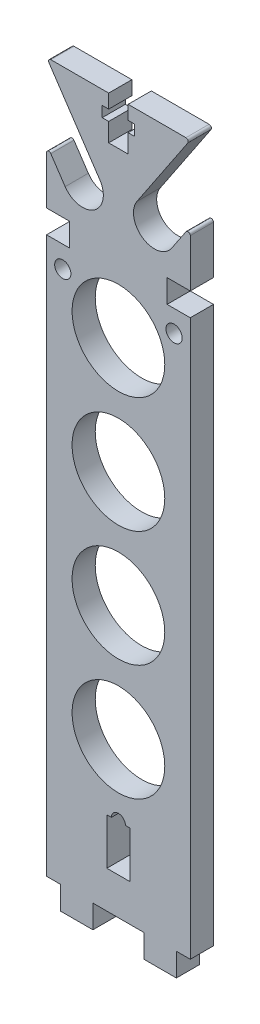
SolidWorks part; units mm, degrees
ref_plane "Plan de face" through (0, 0, 0) normal (0, 0, 1) x (1, 0, 0)
ref_plane "Plan de dessus" through (0, 0, 0) normal (0, 1, 0) x (1, 0, 0)
ref_plane "Plan de droite" through (0, 0, 0) normal (1, 0, 0) x (0, 0, -1)
sketch "Esquisse1" plane through (0, 0, 0) normal (0, 0, 1) x (1, 0, 0)
  line L0 (-15.5, 0) -> (-12.5, 0)
  line L1 (-12.5, 0) -> (-12.5, -5)
  line L2 (-12.5, -5) -> (-5.5, -5)
  line L3 (-5.5, -5) -> (-5.5, 0)
  line L4 (-5.5, 0) -> (5.5, 0)
  line L5 (5.5, 0) -> (5.5, -5)
  line L6 (5.5, -5) -> (12.5, -5)
  line L7 (12.5, -5) -> (12.5, 0)
  line L8 (12.5, 0) -> (15.5, 0)
  line L9 (15.5, 0) -> (15.5, 170)
  line L10 (15.5, 170) -> (-15.5, 170)
  line L11 (-15.5, 170) -> (-15.5, 0)
  dimension "D1" = 7
  dimension "D2" = 7
  dimension "D3" = 3
  dimension "D4" = 3
  dimension "D5" = 170
  dimension "D6" = 11
  dimension "D7" = 15.5
  dimension "D8" = 5
  dimension "D9" = 5
extrude "Boss.-Extru.1" add sketch "Esquisse1" along normal blind 5
sketch "Esquisse6" plane through (0, 0, 0) normal (0, 0, -1) x (-1, 0, 0)
  line L0 (1.5094, 18) -> (2.5, 18)
  line L1 (-2.5, 18) -> (-1.5094, 18)
  line L2 (-2.5, 18) -> (-2.5, 8)
  line L3 (-2.5, 8) -> (2.5, 8)
  line L4 (2.5, 18) -> (2.5, 8)
  arc A1 (1.5094, 18) -> (-1.5094, 18) centre (0, 18) ccw
  point P4 (0, 8)
  dimension "D1" = 10
  dimension "D2" = 5
  dimension "D3" = 0
  dimension "D4" = 8
extrude "Enlèv. mat.-Extru.5" cut sketch "Esquisse6" against normal blind 10
sketch "Esquisse7" plane through (0, 0, 0) normal (0, 0, -1) x (-1, 0, 0)
  line L0 (-4.0103, 135.8329) -> (-15.5, 153)
  line L1 (-15.5, 0) -> (-15.5, 170) construction
  line L3 (-11.4897, 130.8271) -> (-15.5, 136.819)
  line L4 (-15.5, 153) -> (-15.5, 136.819)
  arc A1 (-11.4897, 130.8271) -> (-4.0103, 135.8329) centre (-7.75, 133.33) ccw
  dimension "D1" = 9
  dimension "D2" = 7.75
  dimension "D3" = 133.33
  dimension "D4" = 17
extrude "Enlèv. mat.-Extru.6" cut sketch "Esquisse7" against normal blind 10
mirror "Symétrie1" about plane through (0, 0, 0) normal (1, 0, 0) of "Enlèv. mat.-Extru.6"
sketch "Esquisse9" plane through (0, 0, 0) normal (0, 0, -1) x (-1, 0, 0)
  line L6 (-15.5, 170) -> (15.5, 170)
  line L7 (-15.5, 170) -> (-15.5, 153)
  line L8 (-15.5, 153) -> (15.5, 153)
  line L9 (15.5, 170) -> (15.5, 153)
  dimension "D1" = 17
  dimension "D2" = 31
extrude "Enlèv. mat.-Extru.7" cut sketch "Esquisse9" against normal blind 10
sketch "Esquisse10" plane through (0, 0, 0) normal (0, 0, -1) x (-1, 0, 0)
  circle A0 centre (0, 108.33) radius 10
  arc A1 (4.0103, 135.8329) -> (11.4897, 130.8271) centre (7.75, 133.33) ccw construction
  circle A2 centre (0, 83.33) radius 10
  circle A3 centre (0, 58.33) radius 10
  circle A4 centre (0, 33.33) radius 10
  dimension "D1" = 20
  dimension "D2" = 25
  dimension "D3" = 20
  dimension "D5" = 20
  dimension "D7" = 20
  dimension "D4" = 25
  dimension "D6" = 25
  dimension "D8" = 25
extrude "Enlèv. mat.-Extru.8" cut sketch "Esquisse10" against normal blind 10
fillet "Congé2" radius 0.5 2 edges at (15.5, 153, 2.5) (-15.5, 153, 2.5)
fillet "Congé3" radius 0.5 2 edges at (-15.5, 136.819, 2.5) (15.5, 136.819, 2.5)
sketch "Esquisse11" plane through (0, 0, 0) normal (0, 0, -1) x (-1, 0, 0)
  line L0 (-15.5, 0) -> (-15.5, 135.173) construction
  line L1 (-15.5, 124.83) -> (-10.5, 124.83)
  line L2 (-15.5, 124.83) -> (-15.5, 119.83)
  line L3 (-15.5, 119.83) -> (-10.5, 119.83)
  line L4 (-10.5, 124.83) -> (-10.5, 119.83)
  arc A0 (-11.4897, 130.8271) -> (-4.0103, 135.8329) centre (-7.75, 133.33) ccw construction
  dimension "D3" = 8.5
  dimension "D1" = 5
  dimension "D2" = 5
extrude "Enlèv. mat.-Extru.9" cut sketch "Esquisse11" against normal blind 30
mirror "Symétrie2" about plane through (0, 0, 0) normal (1, 0, 0) of "Enlèv. mat.-Extru.9"
sketch "Esquisse12" plane through (0, 0, 5) normal (0, 0, 1) x (1, 0, 0)
  line L0 (-14.5637, 153) -> (14.5637, 153) construction
  line L1 (-3.5, 150) -> (-2.1, 150)
  line L2 (-3.5, 150) -> (-3.5, 147.7)
  line L3 (-3.5, 147.7) -> (-2.1, 147.7)
  line L4 (3.5, 150) -> (3.5, 147.7)
  line L5 (-2.1, 153) -> (-2.1, 150)
  line L6 (-2.1, 153) -> (2.1, 153)
  line L7 (2.1, 153) -> (2.1, 150)
  line L8 (-2.1, 147.7) -> (-2.1, 143.7)
  line L9 (-2.1, 143.7) -> (2.1, 143.7)
  line L10 (2.1, 143.7) -> (2.1, 147.7)
  line L11 (2.1, 150) -> (3.5, 150)
  line L12 (2.1, 147.7) -> (3.5, 147.7)
  dimension "D1" = 2.3
  dimension "D2" = 7
  dimension "D3" = 3
  dimension "D4" = 4.2
  dimension "D5" = 1.4
  dimension "D6" = 4
extrude "Enlèv. mat.-Extru.10" cut sketch "Esquisse12" against normal blind 5
sketch "Esquisse13" plane through (0, 0, 5) normal (0, 0, 1) x (1, 0, 0)
  line L0 (-15.5, 119.83) -> (-15.5, 0) construction
  circle A0 centre (-12, 115.1511) radius 1.75
  dimension "D1" = 3.5
  dimension "D2" = 3.5
extrude "Enlèv. mat.-Extru.11" cut sketch "Esquisse13" against normal blind 10
mirror "Symétrie3" about plane through (0, 0, 0) normal (1, 0, 0) of "Enlèv. mat.-Extru.11"
